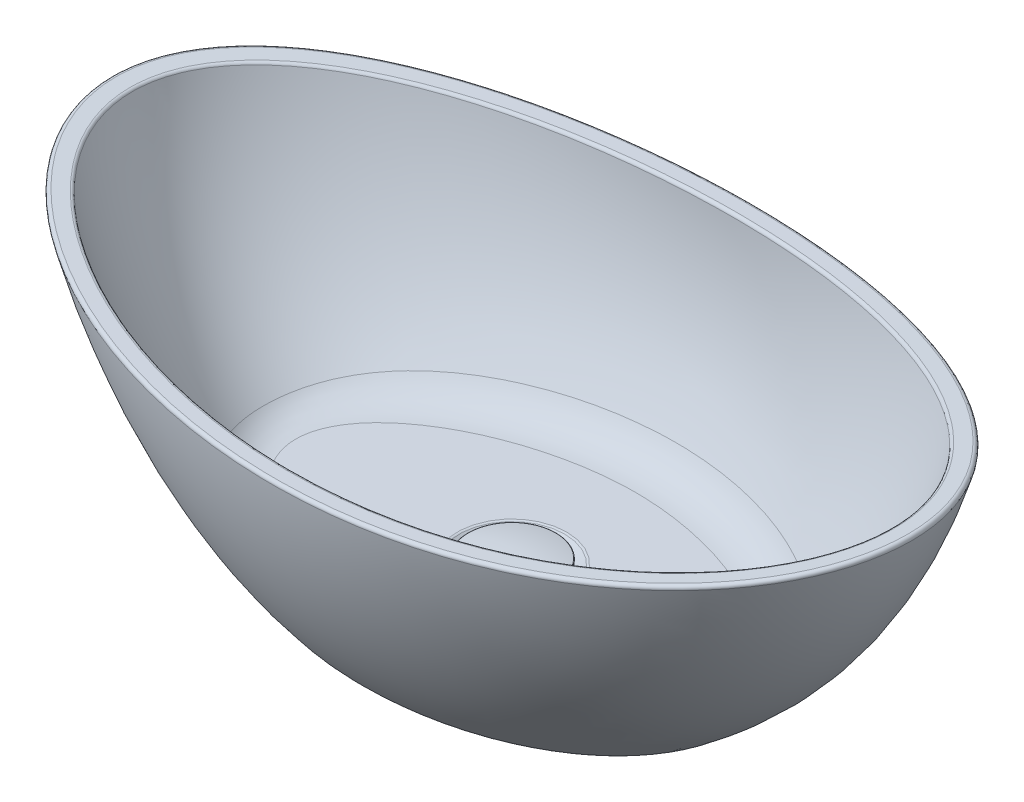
SolidWorks part; units mm, degrees
ref_plane "Płaszczyzna przednia" through (0, 0, 0) normal (0, 0, 1) x (1, 0, 0)
ref_plane "Płaszczyzna górna" through (0, 0, 0) normal (0, 1, 0) x (1, 0, 0)
ref_plane "Płaszczyzna prawa" through (0, 0, 0) normal (1, 0, 0) x (0, 0, -1)
sketch "Szkic1" plane through (0, 0, 0) normal (0, 1, 0) x (1, 0, 0)
  line L1 (-250, -150) -> (250, -150)
  line L2 (-250, -150) -> (-250, 150)
  line L3 (-250, 150) -> (250, 150)
  line L4 (250, -150) -> (250, 150)
  line L5 (-250, -150) -> (250, 150) construction
  line L6 (-250, 150) -> (250, -150) construction
  point P0 (0, 0)
  dimension "D1" = 500
  dimension "D2" = 300
sketch "Szkic4" plane through (0, 0, 0) normal (0, 1, 0) x (1, 0, 0)
  line L0 (-250, -150) -> (250, 150) construction
  line L1 (250, -150) -> (250, 150) construction
  line L2 (-250, 150) -> (250, 150) construction
  ellipse E0 centre (0, 0) end of major axis (-250, 0) minor radius 150
sketch "Szkic2" plane through (0, 0, 0) normal (0, 1, 0) x (1, 0, 0)
  line L0 (250, 0) -> (-250, 0) construction
  line L1 (250, -150) -> (250, 150) construction
  line L2 (-250, -150) -> (-250, 150) construction
  line L3 (0, 150) -> (0, -150) construction
  line L4 (-250, 150) -> (250, 150) construction
  line L5 (-250, -150) -> (250, -150) construction
  arc A0 (-170, 123.5729) -> (170, 123.5729) centre (0, -410) cw
  arc A1 (-170, -123.5729) -> (170, -123.5729) centre (0, 410) ccw
  spline S0 degree 3 poles (-170, 123.5729) (-270.2441, 91.6344) (-229.7559, 0) (-270.2441, -91.6344) (-170, -123.5729) knots 0 0 0 0 0.5 1 1 1 1
  spline S1 degree 3 poles (170, 123.5729) (270.2441, 91.6344) (229.7559, 0) (270.2441, -91.6344) (170, -123.5729) knots 0 0 0 0 0.5 1 1 1 1
  dimension "D1" = 560
  dimension "D2" = 340
sketch "Szkic5" plane through (0, 0, 0) normal (0, 0, 1) x (1, 0, 0)
  line L0 (0, 0) -> (0, -160) construction
  line L1 (140, -160) -> (-140, -160)
  arc A0 (-250, 0) -> (250, 0) centre (0, 1552.5) ccw
  arc A1 (250, 0) -> (140, -160) centre (-38.9104, 80.8134) cw
  arc A2 (-250, 0) -> (-140, -160) centre (38.9104, 80.8134) ccw
  point P8 (0, -20)
  dimension "D3" = 300
  dimension "D1" = 160
  dimension "D2" = 140
  dimension "D4" = 280
sketch "Szkic7" plane through (0, 0, 0) normal (0, 0, 1) x (1, 0, 0)
  arc A0 (-250, 0) -> (250, 0) centre (0, 1552.5) ccw construction
  arc A1 (-402.4468, 32.3708) -> (405.4436, 33.1673) centre (0, 1552.5) ccw
surface "Powierzchnia-Wyciągnięcie1" sketch "Szkic7" parameters "D1"=200, "D2"=200
surface "Powierzchnia-Przytnij1"
sketch "Szkic8" plane through (0, 0, 0) normal (1, 0, 0) x (0, 0, -1)
  line L0 (-150, -20) -> (150, -20)
  line L1 (-175, -20) -> (150, -20) construction
  line L2 (0, 0) -> (0, -160) construction
  line L3 (0, 0) -> (0, -160) construction
  line L4 (0, 0) -> (0, -160) construction
  line L5 (0, -160) -> (92.5, -160) construction
  arc A0 (150, -20) -> (92.5, -160) centre (-99.1561, 0.5239) cw
  arc A1 (-150, -20) -> (-92.5, -160) centre (99.1561, 0.5239) ccw
  dimension "D1" = 250
  dimension "D2" = 185
ref_plane "Płaszczyzna1" through (0, -160, 0) normal (0, 1, 0) x (-1, 0, 0)
sketch "Szkic9" plane through (0, -160, 0) normal (0, 1, 0) x (-1, 0, 0)
  line L0 (140, 0) -> (-140, 0) construction
  line L1 (0, 92.5) -> (0, -92.5) construction
  line L2 (-140, 63.6904) -> (-140, -63.6904) construction
  arc A0 (-50, 85.803) -> (50, 85.803) centre (0, -97.5) cw construction
  arc A2 (-50, -85.803) -> (50, -85.803) centre (0, 97.5) ccw construction
  ellipse E0 centre (0, 0) end of major axis (-140, 0) minor radius 92.5
  spline S0 degree 3 poles (-50, 85.803) (-105.9001, 70.555) (-174.0999, 0) (-105.9001, -70.555) (-50, -85.803) knots 0 0 0 0 0.5 1 1 1 1 construction
  spline S1 degree 3 poles (50, 85.803) (105.9001, 70.555) (174.0999, 0) (105.9001, -70.555) (50, -85.803) knots 0 0 0 0 0.5 1 1 1 1 construction
  dimension "D1" = 190
  dimension "D2" = 100
surface "Powierzchnia-Wyciągnięcie po profilach1"
surface "Powierzchnia-Odsunięcie1" parameters "D1"=12
surface "Powierzchnia-Przytnij2"
sketch "Szkic10" plane through (0, 0, 0) normal (0, 0, 1) x (1, 0, 0)
  line L0 (0, 0) -> (0, -160) construction
  line L1 (165, -160) -> (-165, -160) construction
  line L2 (-22.5, -160) -> (-22.7884, -148.9881)
  line L3 (-22.7884, -148.9881) -> (-33.5, -140)
  line L4 (-33.5, -140) -> (-370.815, -140)
  dimension "D1" = 90
  dimension "D2" = 50
  dimension "D3" = 67
  dimension "D4" = 1.5
  dimension "D5" = 45
  dimension "D6" = 20
surface "Powierzchnia-Obrót1" sketch "Szkic10" parameters "D1"=360
surface "Powierzchnia-Przytnij3"
surface "Powierzchnia-Płaszczyzna1"
surface "Powierzchnia-Połącz1"
fillet "Zaokrąglenie2" radius 30 1 edges at (3.5264, -140, 92.8987)
fillet "Zaokrąglenie5" radius 2 5 edges at (-6.3781, -19.9871, 137.9065) (0, -148.9881, -22.7884) (0, -140, -33.5)
sketch "Szkic11" plane through (0, 0, 0) normal (0, 0, 1) x (1, 0, 0)
  line L0 (0, 0) -> (0, -160) construction
  line L1 (-22.5, -160) -> (22.5, -160) construction
  line L2 (0, -138) -> (27.5, -138)
  line L3 (27.5, -138) -> (27.5, -137)
  line L4 (0, -134) -> (-5.712, -134) construction
  line L5 (0, -138) -> (0, -134)
  arc A0 (0, -134) -> (27.5, -137) centre (0, -261.5417) cw
  dimension "D1" = 55
  dimension "D2" = 4
  dimension "D3" = 1
  dimension "D4" = 22
revolve "Obrót1" add sketch "Szkic11" angle 360 about L0
fillet "Zaokrąglenie4" radius 0.5 1 edges at (0, -137, 27.5)
